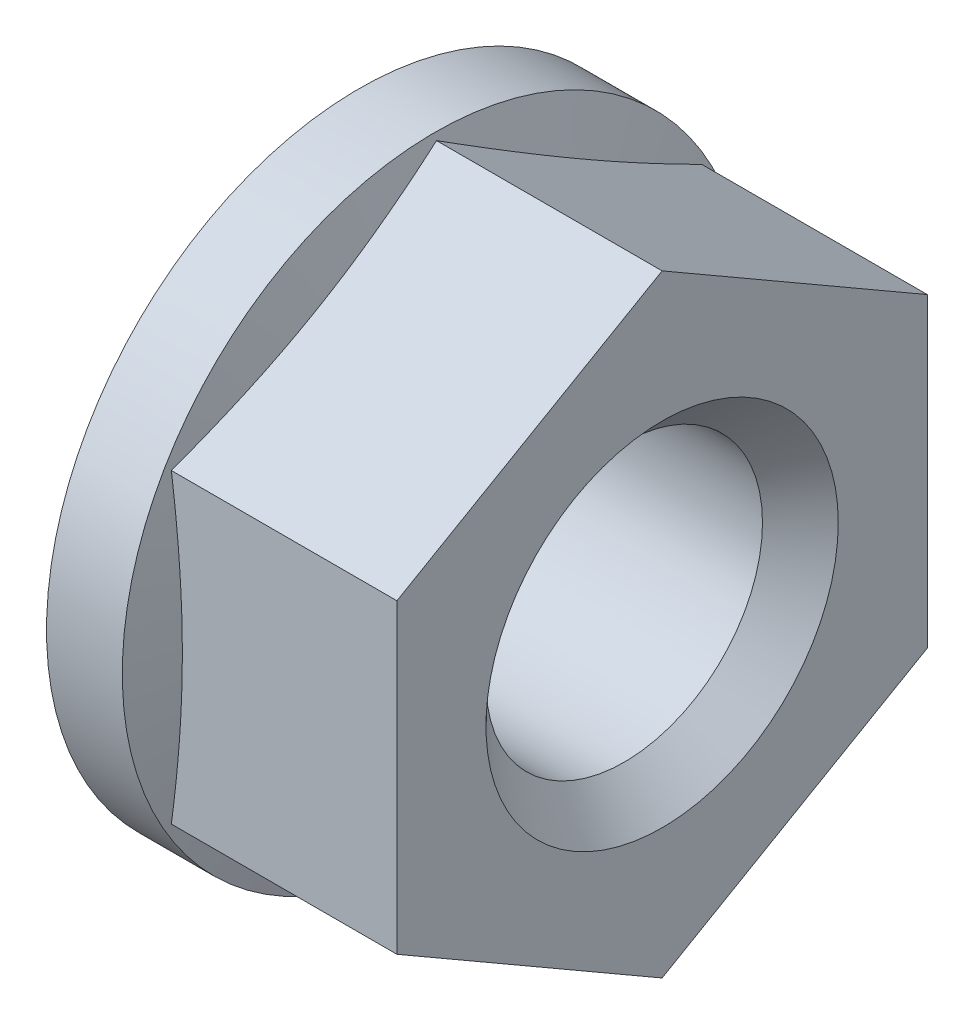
SolidWorks part; units mm, degrees
ref_plane "Front Plane" through (0, 0, 0) normal (0, 0, 1) x (1, 0, 0)
ref_plane "Top Plane" through (0, 0, 0) normal (0, 1, 0) x (1, 0, 0)
ref_plane "Right Plane" through (0, 0, 0) normal (1, 0, 0) x (0, 0, -1)
sketch "Sketch1" plane through (0, 0, 0) normal (0, 0, 1) x (1, 0, 0)
  line L0 (0, 8.25) -> (0, 0)
  line L1 (0, 0) -> (4.2106, 0)
  line L2 (4.2106, 0) -> (2, 8.25)
  line L3 (2, 8.25) -> (0, 8.25)
  line L4 (0, 0) -> (4.2106, 0) construction
revolve "Revolve1" add sketch "Sketch1" angle 360 about L4
imported_body "Surface-Imported1"
ref_plane "Plane1" through (8, 0, 0) normal (1, 0, 0) x (0, 0, -1)
sketch "Sketch2" plane through (8, 0, 0) normal (1, 0, 0) x (0, 0, -1)
  line L0 (-7, -4.0415) -> (0, -8.0829)
  line L1 (0, -8.0829) -> (7, -4.0415)
  line L2 (7, -4.0415) -> (7, 4.0415)
  line L3 (7, 4.0415) -> (0, 8.0829)
  line L4 (0, 8.0829) -> (-7, 4.0415)
  line L5 (-7, 4.0415) -> (-7, -4.0415)
extrude "Boss-Extrude1" add sketch "Sketch2" against normal up to surface
hole_wizard "Ø7.3 (7.3) Diameter Hole1" positions "Sketch4" profile "Sketch3" hole size "Ø7.3" standard "Ansi Metric"
sketch "Sketch4" plane through (8, 0, 0) normal (1, 0, 0) x (0, 0, -1)
  point P0 (0, 0)
sketch "Sketch3" plane through (8, 0, 0) normal (0, 1, 0) x (0, 0, -1)
  line L0 (0, 0) -> (0, 17.1931)
  line L1 (0, 17.1931) -> (3.65, 15)
  line L2 (3.65, 15) -> (3.65, 0)
  line L5 (3.65, 0) -> (0, 0)
  line L10 (0, 17.1931) -> (-3.65, 15) construction
  line L11 (0, -6.35) -> (0, 107.95) construction
  dimension "Hole Dia." = 7.3
  dimension "Hole Depth" = 15
  dimension "Drill Angle" = 118
chamfer "Chamfer1" distance 1 angle 45 1 edges at (8, 0, -3.65)
